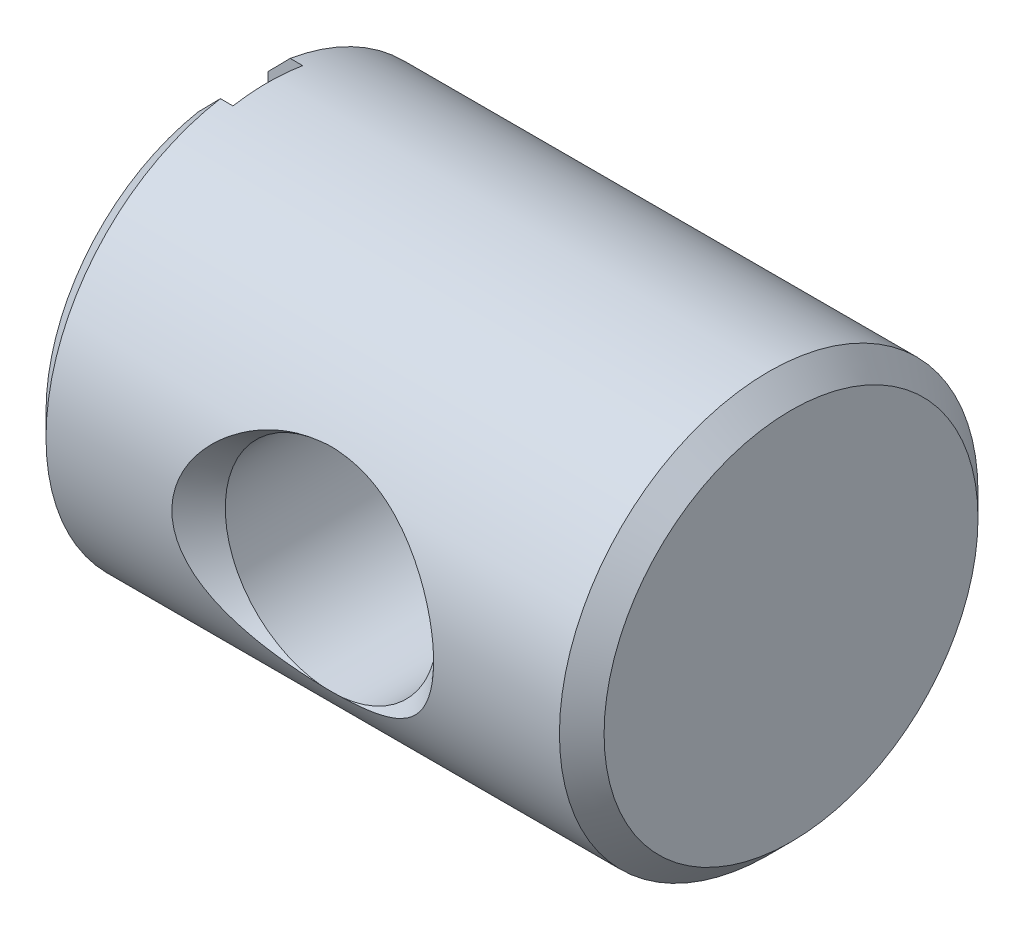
SolidWorks part; units mm, degrees
ref_plane "Front" through (0, 0, 0) normal (0, 0, 1) x (1, 0, 0)
ref_plane "Top" through (0, 0, 0) normal (0, 1, 0) x (1, 0, 0)
ref_plane "Right" through (0, 0, 0) normal (1, 0, 0) x (0, 0, -1)
sketch "Sketch1" plane through (0, 0, 0) normal (1, 0, 0) x (0, 0, -1)
  circle A0 centre (0, 0) radius 4.7625
  dimension "D1" = 9.525
extrude "Extrude1" add sketch "Sketch1" along normal blind 12.7
ref_plane "Plane1" through (6.35, 0, 0) normal (1, 0, 0) x (0, 0, -1)
sketch "Sketch3" plane through (6.35, 12.7, 0) normal (1, 0, 0) x (0, -1, 0)
  line L0 (12.7, 10.2562) -> (12.7, 1.3361)
  line L2 (12.7, 2.4517) -> (12.7, 7.112) construction
  line L3 (12.7, 1.3361) -> (16.6688, 5.9017)
  line L4 (12.7, 10.2562) -> (20.4541, 10.2562)
  line L5 (16.6688, 5.9017) -> (20.4541, 10.2562)
  line L6 (12.7, -10.2562) -> (12.7, -1.3361)
  line L7 (12.7, -10.2562) -> (20.4541, -10.2562)
  line L8 (16.6688, -5.9017) -> (20.4541, -10.2562)
  line L9 (12.7, -1.3361) -> (16.6688, -5.9017)
revolve "Cut-Revolve4" cut sketch "Sketch3" angle 360 about L2
chamfer "Chamfer1" distance 0.508 angle 45 2 edges at (0, 0, -4.7625) (12.7, 0, -4.7625)
ref_plane "Plane2" through (0, 0, 7.62) normal (0, 0, 1) x (1, 0, 0)
hole_wizard "#10-32 Tapped Hole1" positions "Sketch7" profile "Sketch6" tap size "#10-32" standard "Ansi Inch"
sketch "Sketch7" plane through (0, 0, 7.62) normal (0, 0, 1) x (1, 0, 0)
  line L1 (0, 4.2545) -> (0, -4.2545) construction
  point P2 (6.35, 0)
  dimension "D1" = 6.35
sketch "Sketch6" plane through (6.35, 0, 7.62) normal (1, 0, 0) x (0, -1, 0)
  line L0 (0, 0) -> (0, 12.3825)
  line L1 (0, 12.3825) -> (2.413, 12.3825)
  line L2 (2.413, 12.3825) -> (2.413, 0)
  line L5 (2.413, 0) -> (0, 0)
  line L11 (0, -6.35) -> (0, 107.95) construction
  dimension "Thread Major Dia." = 4.826
  dimension "Thru Tap Drill Depth" = 12.3825
ref_plane "Plane3" through (6.35, 4.7625, 0) normal (0, 1, 0) x (0, 0, -1)
ref_plane "Plane4" through (0, 0, 7.112) normal (0, 0, 1) x (1, 0, 0)
sketch "Sketch8" plane through (0, 0, 0) normal (-1, 0, 0) x (0, 0, 1)
  line L0 (0, 0) -> (0, -5.276) construction
  line L1 (-0.7937, 5.009) -> (0.7937, 5.009)
  line L2 (-0.7937, 5.009) -> (-0.7937, -5.009)
  line L3 (-0.7937, -5.009) -> (0.7938, -5.009)
  line L5 (0.7937, 5.009) -> (0.7938, -5.009)
extrude "Cut-Extrude1" cut sketch "Sketch8" against normal blind 0.7937
